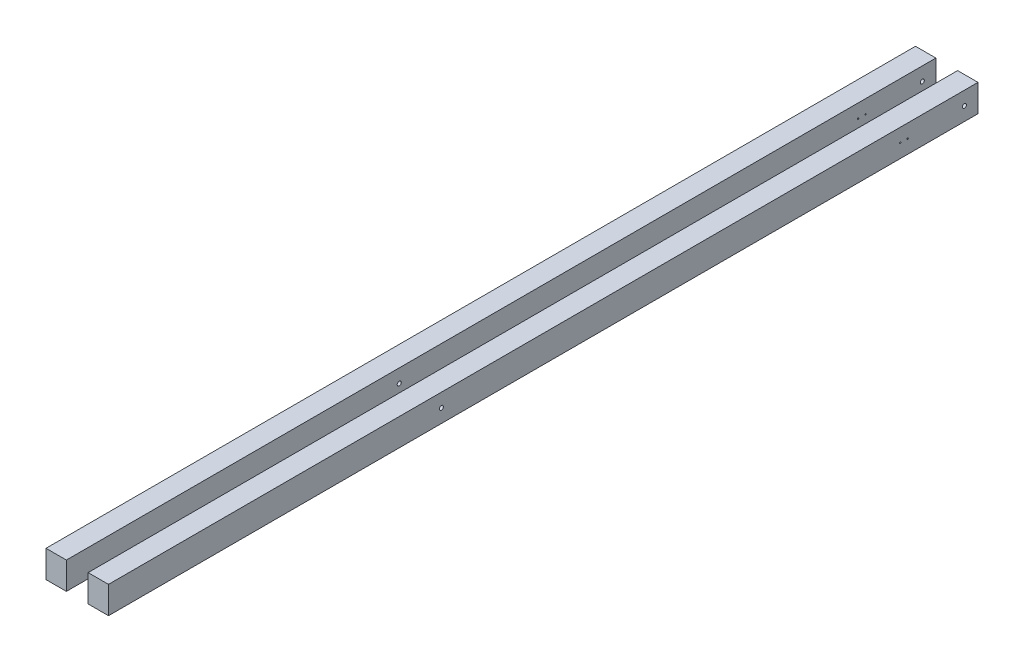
SolidWorks part; units mm, degrees
ref_plane "Plan de face" through (0, 0, 0) normal (0, 0, 1) x (1, 0, 0)
ref_plane "Plan de dessus" through (0, 0, 0) normal (0, 1, 0) x (1, 0, 0)
ref_plane "Plan de droite" through (0, 0, 0) normal (1, 0, 0) x (0, 0, -1)
sketch "Esquisse1" plane through (0, 0, 0) normal (0, 0, 1) x (1, 0, 0)
  line L0 (46, -20) -> (16, -20)
  line L1 (-16, -20) -> (-46, -20)
  line L2 (-16, -20) -> (-16, 20)
  line L3 (-16, 20) -> (-46, 20)
  line L4 (-46, -20) -> (-46, 20)
  line L5 (-16, -20) -> (-46, 20) construction
  line L6 (-16, 20) -> (-46, -20) construction
  line L7 (46, -20) -> (46, 20)
  line L8 (46, 20) -> (16, 20)
  line L9 (16, -20) -> (16, 20)
  line L10 (46, -20) -> (16, 20) construction
  line L11 (46, 20) -> (16, -20) construction
  line L12 (0, 0) -> (0, 76.1814) construction
  point P0 (-31, 0)
  point P6 (31, 0)
  dimension "D2" = 32
  dimension "D3" = 30
  dimension "D4" = 40
  dimension "D1" = 2
extrude "Boss.-Extru.1" add sketch "Esquisse1" along normal blind 1280
sketch "Esquisse2" plane through (0, 0, 0) normal (1, 0, 0) x (0, 0, -1)
  line L0 (116.325, 38.8031) -> (-140.0555, -75.3449) construction
  line L1 (116.325, 38.8031) -> (100.0555, 75.3449) construction
  line L2 (-140.0555, -75.3449) -> (-156.325, -38.8031) construction
  line L3 (100.0555, 75.3449) -> (-156.325, -38.8031) construction
  line L4 (116.325, 38.8031) -> (-156.325, -38.8031) construction
  line L5 (-140.0555, -75.3449) -> (100.0555, 75.3449) construction
  line L6 (-1280, -20) -> (0, -20) construction
  circle A0 centre (-790, 0) radius 3
  circle A1 centre (-20, 0) radius 3
  circle A2 centre (-114.3976, 0) radius 1
  circle A3 centre (-103.5922, 0) radius 1
  point P11 (0, 0)
  dimension "D2" = 20
  dimension "D3" = 6
  dimension "D5" = 2
  dimension "D6" = 83.5922
  dimension "D7" = 24
  dimension "D8" = 40
  dimension "D9" = 14
  dimension "D1" = 2
  dimension "D4" = 2
extrude "Enlèv. mat.-Extru.1" cut sketch "Esquisse2" against normal through all both and the other way through all
